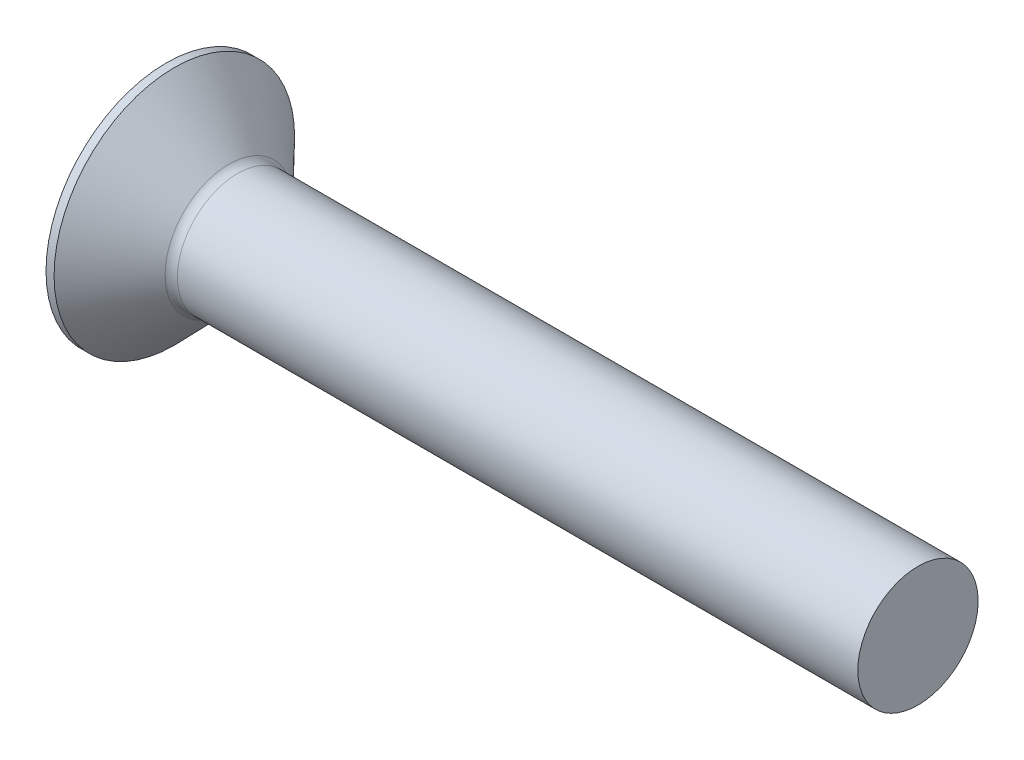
SolidWorks part; units mm, degrees
ref_plane "Front Plane" through (0, 0, 0) normal (0, 0, 1) x (1, 0, 0)
ref_plane "Top Plane" through (0, 0, 0) normal (0, 1, 0) x (1, 0, 0)
ref_plane "Right Plane" through (0, 0, 0) normal (1, 0, 0) x (0, 0, -1)
sketch "BodySke" plane through (0, 0, 0) normal (0, 0, 1) x (1, 0, 0)
  line L0 (0, 0) -> (111.3824, 0) construction
  line L1 (0, 0) -> (0, 8)
  line L2 (0, 8) -> (0.5372, 8)
  line L3 (0.5372, 8) -> (4.4, 4)
  line L4 (4.4, 4) -> (50, 4)
  line L5 (50, 4) -> (50, 0)
  line L6 (5.65, 7.824) -> (5.65, -6.8939) construction
  line L7 (0, 0) -> (50, 0)
  line L8 (20, 8.824) -> (20, -4.958) construction
  line L9 (0, -8) -> (0.5372, -8) construction
  line L10 (0.5372, -8) -> (4.4, -4) construction
  line L11 (4.4, -4) -> (50, -4) construction
  point P10 (50, 3.4455)
  dimension "Diameter" = 8
  dimension "Head_dia" = 16
  dimension "Head_height" = 4.4
  dimension "Length" = 50
  dimension "Advance" = 1.25
  dimension "Thread_minor" = 6.891
  dimension "Thread_length" = 30
  dimension "Head_ang" = 92
revolve "BaseBody" add sketch "BodySke" angle 360 about L0
fillet "Fillet1" radius 0.8 1 edges at (4.4, 0, 4)
ref_plane "Plane1" through (4.96, 0, 0) normal (1, 0, 0) x (0, 0, -1)
sketch "RecSkeTop" plane through (0, 0, 0) normal (-1, 0, 0) x (0, 0, 1)
  line L1 (-0.924, 4.2) -> (0.924, 4.2)
  line L2 (-0.924, 4.2) -> (-0.924, -4.2)
  line L3 (-0.924, -4.2) -> (0.924, -4.2)
  line L4 (0.924, 4.2) -> (0.924, -4.2)
  dimension "D1" = 4.2
  dimension "Cross_dia" = 8.4
  dimension "D2" = 1.848
  dimension "D3" = 0.924
sketch "RecSkeBot" plane through (4.96, 0, 0) normal (1, 0, 0) x (0, 0, -1)
  line L0 (0.924, 4.2) -> (0.924, -4.2) construction
  line L1 (0.924, 1.727) -> (-0.924, 1.727)
  line L2 (0.924, 1.727) -> (0.924, -1.727)
  line L3 (0.924, -1.727) -> (-0.924, -1.727)
  line L4 (-0.924, 1.727) -> (-0.924, -1.727)
  line L5 (-0.924, 4.2) -> (-0.924, -4.2) construction
  dimension "D1" = 3.4541
  dimension "D2" = 1.727
loft "Recess" cut profiles "RecSkeTop", "RecSkeBot"
pattern_circular "RecPat" count 2 every 90 about axis through (0, 0, 0) along (1, 0, 0) of "Recess"
sketch "RecCorSke" plane through (0, 0, 0) normal (0, 0, 1) x (1, 0, 0)
  line L0 (0, 0) -> (57.5987, 0) construction
  line L1 (0, 0) -> (0, 2.0328)
  line L2 (0, 8) -> (0, -8) construction
  line L3 (0, 2.0328) -> (4.96, 1.686)
  line L4 (4.96, 1.686) -> (5.5078, 0)
  line L5 (5.5078, 0) -> (0, 0)
  dimension "D1" = 18
  dimension "D2" = 4.96
  dimension "D3" = 2.0328
  dimension "D4" = 4
revolve "RecessCore" cut sketch "RecCorSke" angle 360 about L0
sketch "ThdSchSke" plane through (0, 0, 0) normal (0, 0, 1) x (1, 0, 0)
  line L0 (0, 0) -> (55.1256, 0) construction
  line L1 (0, 0) -> (111.3824, 0) construction
  line L2 (49.6799, 4) -> (49.6799, 4.6403)
  line L3 (49.6799, 4.6403) -> (50.3201, 4.6403)
  line L4 (50.3201, 4.6403) -> (50.3201, 4)
  line L5 (50.3201, 4) -> (50, 3.4455)
  line L6 (50, 3.4455) -> (49.6799, 4)
  line L7 (4.4, 4) -> (50, 4) construction
  line L13 (50, 4) -> (50, 0) construction
revolve "ThreadSchematic" [suppressed] cut sketch "ThdSchSke" angle 360 about L0
pattern_linear "ThdSchPat" [suppressed] count 24 along (1, 0, 0)
equation "\"Thread_minor@ThreadCosmetic\" = \"Thread_minor@BodySke\""
equation "\"D1@RecSkeTop\" = \"Cross_dia@RecSkeTop\" / 2"
equation "\"D2@RecSkeTop\" = \"Cross_dia@RecSkeTop\" * 0.22"
equation "\"D3@RecSkeTop\" = \"D2@RecSkeTop\" / 2"
equation "\"D1@RecSkeBot\" = \"Cross_dia@RecSkeTop\" - 2 * \"Cross_depth@Plane1\" *  tan( 26.5 * 0.017453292 ) "
equation "\"D2@RecSkeBot\" = \"D1@RecSkeBot\" / 2"
equation "\"D2@RecCorSke\" = \"Cross_depth@Plane1\""
equation "\"D3@RecCorSke\" = \"D2@RecSkeTop\" * 1.1"
equation "\"Advance@ThdSchPat\" = \"Advance@BodySke\""
equation "\"D1@ThdSchPat\" =  int( \"Thread_length@BodySke\" / \"Advance@ThdSchPat\" ) "
